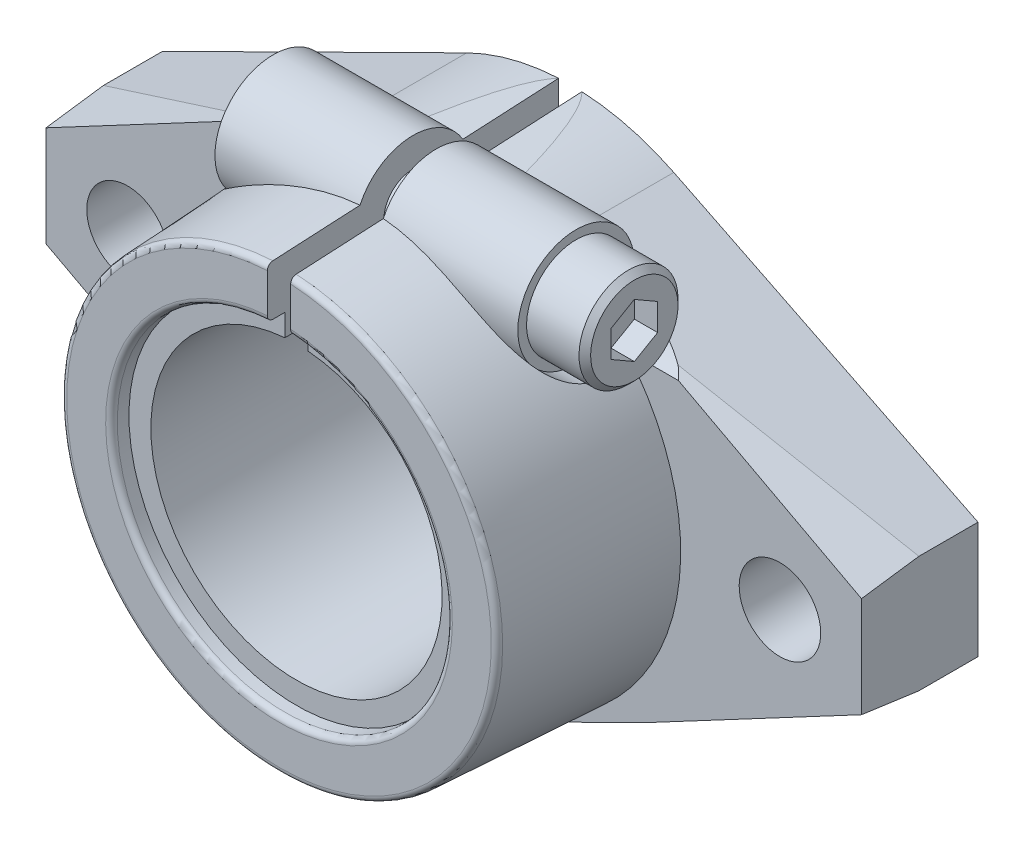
SolidWorks part; units mm, degrees
other "Solid1"
ref_plane "Front Plane" through (0, 0, 0) normal (0, 0, 1) x (1, 0, 0)
ref_plane "Top Plane" through (0, 0, 0) normal (0, 1, 0) x (1, 0, 0)
ref_plane "Right Plane" through (0, 0, 0) normal (1, 0, 0) x (0, 0, -1)
imported_body "2.7124 SHF25.stp<1>"
fillet "Fillet1" radius 0.5
